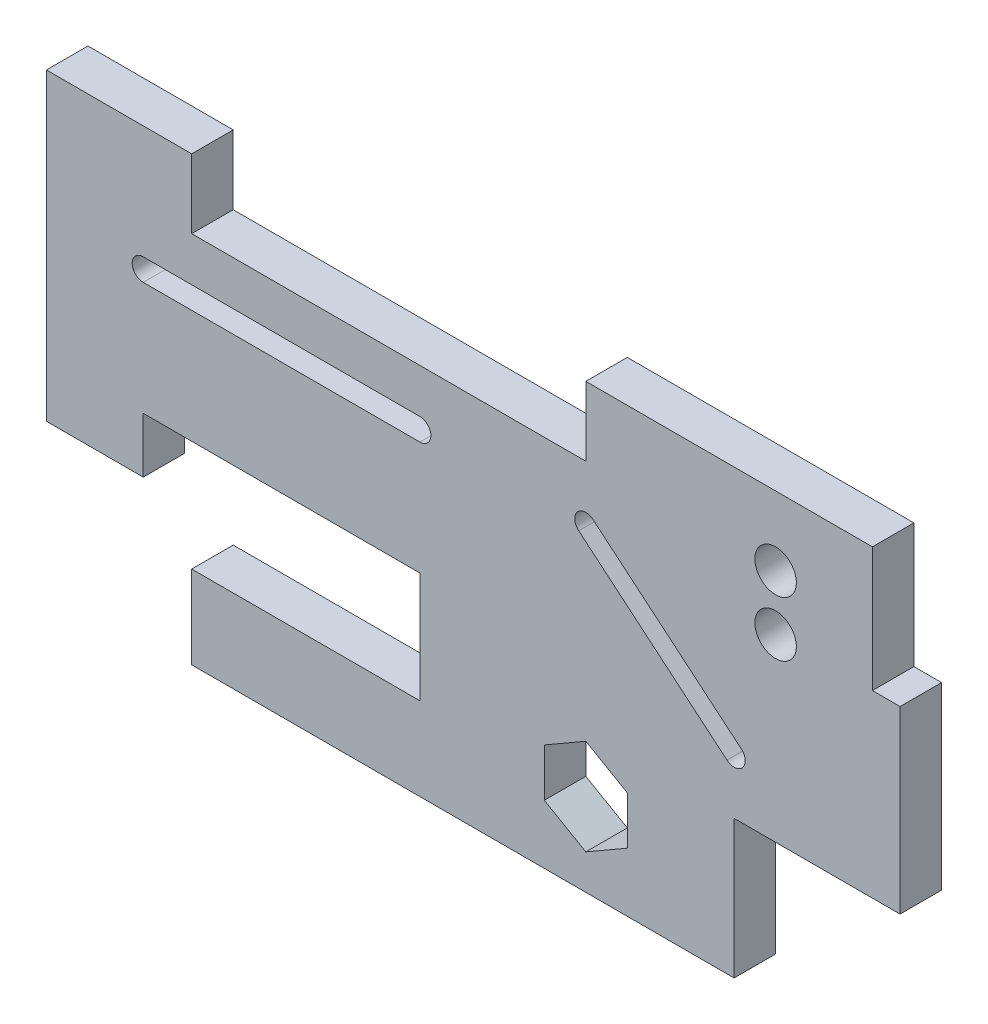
SolidWorks part; units mm, degrees
ref_plane "Front Plane" through (0, 0, 0) normal (0, 0, 1) x (1, 0, 0)
ref_plane "Top Plane" through (0, 0, 0) normal (0, 1, 0) x (1, 0, 0)
ref_plane "Right Plane" through (0, 0, 0) normal (1, 0, 0) x (0, 0, -1)
sketch "Sketch1" plane through (0, 0, 0) normal (0, 0, 1) x (1, 0, 0)
  line L0 (0, 0) -> (0, 25.4)
  line L1 (0, 25.4) -> (-63.5, 25.4)
  line L2 (-63.5, 25.4) -> (-63.5, 12.7)
  line L3 (-63.5, 12.7) -> (-85.725, 12.7)
  line L4 (-85.725, 12.7) -> (-85.725, 82.55)
  line L5 (-85.725, 82.55) -> (-52.3748, 82.55)
  line L6 (-52.3748, 82.55) -> (-52.3748, 66.675)
  line L7 (-52.3748, 66.675) -> (38.1, 66.675)
  line L8 (38.1, 66.675) -> (38.1, 82.55)
  line L9 (38.1, 82.55) -> (103.8981, 82.55)
  line L10 (103.8981, 82.55) -> (103.8981, 53.975)
  line L11 (103.8981, 53.975) -> (110.2481, 53.975)
  line L12 (110.2481, 53.975) -> (110.2481, 12.7)
  line L13 (110.2481, 12.7) -> (72.1481, 12.7)
  line L14 (72.1481, 12.7) -> (72.1481, -19.05)
  line L15 (72.1481, -19.05) -> (-52.3748, -19.05)
  line L16 (-52.3748, -19.05) -> (-52.3748, 0)
  line L17 (-52.3748, 0) -> (0, 0)
  line L18 (-63.5, 53.975) -> (0, 53.975) construction
  line L19 (38.1, 10.9985) -> (28.575, 5.4993)
  line L20 (28.575, 5.4993) -> (28.575, -5.4993)
  line L21 (28.575, -5.4993) -> (38.1, -10.9985)
  line L22 (38.1, -10.9985) -> (47.625, -5.4993)
  line L23 (47.625, -5.4993) -> (47.625, 5.4993)
  line L24 (47.625, 5.4993) -> (38.1, 10.9985)
  line L25 (-63.5, 56.515) -> (0, 56.515)
  line L26 (-63.5, 51.435) -> (0, 51.435)
  line L27 (38.1, 53.975) -> (72.1481, 25.4) construction
  line L28 (39.7329, 55.9206) -> (73.7809, 27.3456)
  line L29 (36.4671, 52.0294) -> (70.5152, 23.4544)
  circle A0 centre (81.6731, 53.975) radius 4.7625
  circle A1 centre (81.6731, 66.675) radius 4.7625
  circle A2 centre (38.1, 0) radius 9.525 construction
  arc A3 (-63.5, 56.515) -> (-63.5, 51.435) centre (-63.5, 53.975) ccw
  arc A4 (0, 51.435) -> (0, 56.515) centre (0, 53.975) ccw
  arc A5 (39.7329, 55.9206) -> (36.4671, 52.0294) centre (38.1, 53.975) ccw
  arc A6 (70.5152, 23.4544) -> (73.7809, 27.3456) centre (72.1481, 25.4) ccw
  point P23 (-31.75, 53.975)
  point P38 (55.124, 39.6875)
  point P53 (-63.5, 19.05)
  dimension "D3" = 19.05
  dimension "D4" = 2.54
  dimension "D5" = 9.525
  dimension "D6" = 19.05
  dimension "D7" = 31.75
  dimension "D8" = 73.025
  dimension "D9" = 44.45
  dimension "D10" = 101.6
  dimension "D11" = 22.225
  dimension "D12" = 33.3502
  dimension "D13" = 15.875
  dimension "D14" = 85.725
  dimension "D15" = 38.1
  dimension "D16" = 9.525
  dimension "D17" = 6.35
  dimension "D18" = 31.75
  dimension "D20" = 44.45
other "AlignGroup1"
other "AlignGroup2"
extrude "Boss-Extrude1" add sketch "Sketch1" along normal blind 9.525
